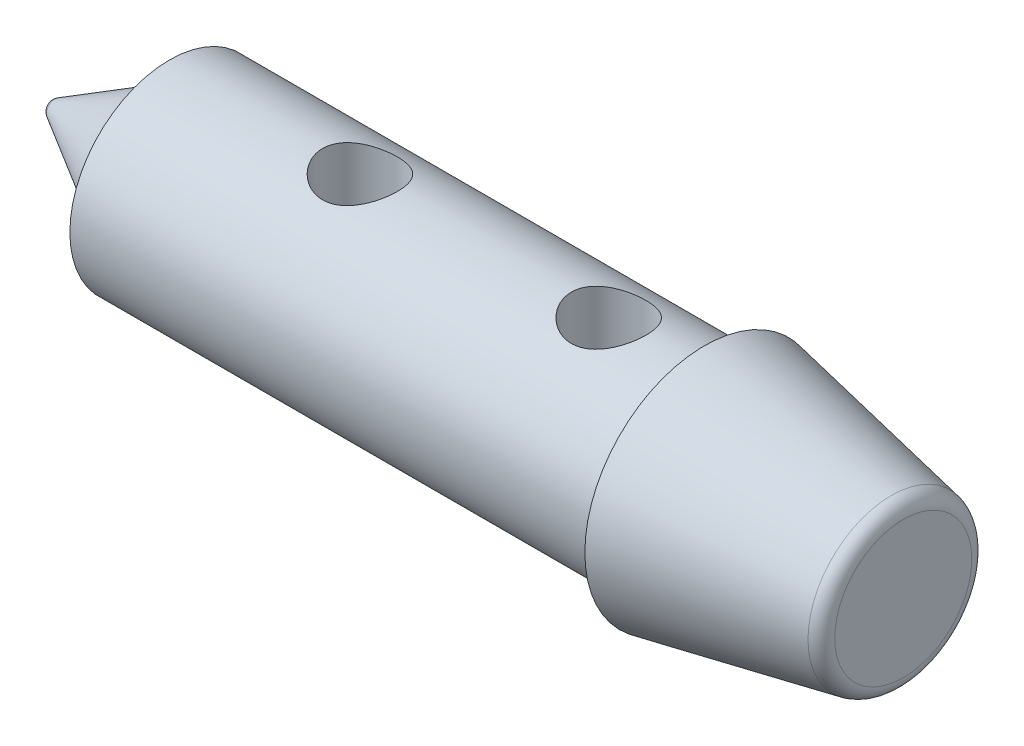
SolidWorks part; units mm, degrees
ref_plane "Plan de face" through (0, 0, 0) normal (0, 0, 1) x (1, 0, 0)
ref_plane "Plan de dessus" through (0, 0, 0) normal (0, 1, 0) x (1, 0, 0)
ref_plane "Plan de droite" through (0, 0, 0) normal (1, 0, 0) x (0, 0, -1)
sketch "Esquisse1" plane through (0, 0, 0) normal (0, 0, 1) x (1, 0, 0)
  line L0 (0, 0) -> (59.0836, 0) construction
  line L1 (4.3962, 4) -> (25.8962, 4)
  line L2 (25.8962, 4) -> (25.8962, 4.8)
  line L3 (25.8962, 4.8) -> (33.8962, 3.25)
  line L4 (33.8962, 3.25) -> (33.8962, 0)
  line L5 (-0.4, 0) -> (33.8962, 0)
  line L6 (4.3962, 4) -> (4.3962, 3)
  line L7 (4.3962, 3) -> (-0.2, 0.3464)
  arc A0 (-0.2, 0.3464) -> (-0.4, 0) centre (0, 0) ccw
  dimension "D6" = 1
  dimension "D8" = 0.8
  dimension "D1" = 8
  dimension "D2" = 9.6
  dimension "D3" = 6.5
  dimension "D4" = 21.5
  dimension "D5" = 8
  dimension "D7" = 30
revolve "Révolution1" add sketch "Esquisse1" angle 360 about L0
scale "Echelle1" scale about centroid uniform scaling yes scale factor 1.25
ref_plane "Plan1" through (0, -5, 0) normal (0, 1, 0) x (1, 0, 0)
hole_wizard "Diamètre du perçage Ø3.7 (3.7)6" positions "Esquisse10" profile "Esquisse9" hole size "Ø3.7" standard "Ansi Metric"
sketch "Esquisse10" plane through (0, -5, 0) normal (0, 1, 0) x (1, 0, 0)
  line L0 (27.7273, 6) -> (27.7273, -6) construction
  point P0 (10.4273, 0)
  point P2 (22.9273, 0)
  dimension "D1" = 4.8
  dimension "D2" = 12.5
sketch "Esquisse9" plane through (10.4273, -5, 0) normal (1, 0, 0) x (0, 0, -1)
  line L0 (0, 0) -> (0, 11)
  line L1 (0, 11) -> (1.875, 11)
  line L2 (1.875, 11) -> (1.875, 0)
  line L5 (1.875, 0) -> (0, 0)
  line L11 (0, -6.35) -> (0, 107.95) construction
  dimension "Diamètre du perçage jusqu'au prochain" = 3.75
  dimension "Profondeur du perçage jusqu'au prochain" = 11
fillet "Congé1" radius 0.75 1 edges at (37.7273, 0, 4.0625)
fillet "Congé2" radius 0.2 1 edges at (27.7273, 0, 5)
